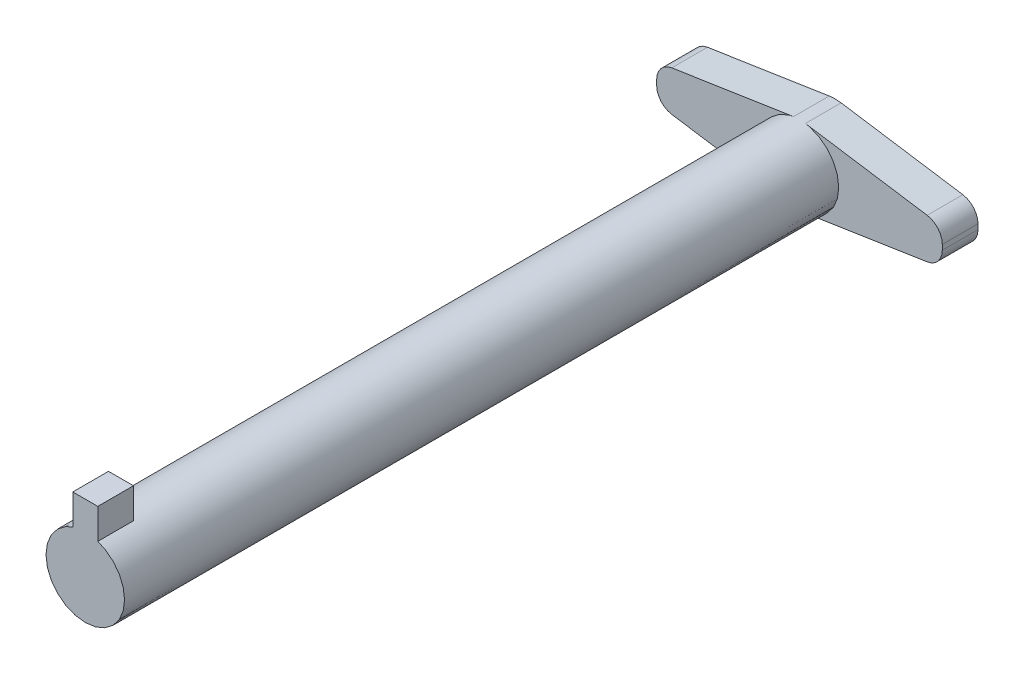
SolidWorks part; units mm, degrees
ref_plane "Front Plane" through (0, 0, 0) normal (0, 0, 1) x (1, 0, 0)
ref_plane "Top Plane" through (0, 0, 0) normal (0, 1, 0) x (1, 0, 0)
ref_plane "Right Plane" through (0, 0, 0) normal (1, 0, 0) x (0, 0, -1)
sketch "Sketch1" plane through (0, 0, 0) normal (0, 0, 1) x (1, 0, 0)
  circle A0 centre (0, 0) radius 2.413
  dimension "D1" = 4.826
extrude "Boss-Extrude1" add sketch "Sketch1" along normal blind 11.176
sketch "Sketch2" plane through (0, 0, 0) normal (0, 0, -1) x (-1, 0, 0)
  line L0 (0.2734, 2.3975) -> (10.16, 1.27)
  line L1 (10.16, 1.27) -> (10.16, -1.27)
  line L2 (10.16, -1.27) -> (0.2734, -2.3975)
  circle A0 centre (0, 0) radius 2.413 construction
  arc A1 (-0.2734, -2.3975) -> (0.2734, -2.3975) centre (0, 0) ccw
  arc A2 (0.2734, 2.3975) -> (-0.2734, 2.3975) centre (0, 0) ccw
  arc A3 (0.2734, 2.3975) -> (0.2734, -2.3975) centre (0, 0) ccw
  dimension "D2" = 2.54
  dimension "D4" = 10.16
extrude "Boss-Extrude2" add sketch "Sketch2" along normal blind 2.54 contours L2 L1 L0 M7 | M7
fillet "Fillet1" radius 1.27 2 edges at (-10.16, -1.27, -1.27) (-10.16, 1.27, -1.27)
sketch "Sketch3" plane through (0, 0, 11.176) normal (0, 0, 1) x (1, 0, 0)
  line L0 (-0.889, 2.2433) -> (-0.889, 4.4023)
  line L1 (-0.889, 4.4023) -> (0.889, 4.4023)
  line L2 (0.889, 4.4023) -> (0.889, 2.2433)
  circle A0 centre (0, 0) radius 2.413 construction
  arc A1 (0.2734, -2.3975) -> (0.2734, 2.3975) centre (0, 0) ccw construction
  arc A2 (0.889, 2.2433) -> (-0.889, 2.2433) centre (0, 0) ccw
  dimension "D1" = 1.778
  dimension "D2" = 0.889
  dimension "D3" = 2.159
extrude "Boss-Extrude3" add sketch "Sketch3" against normal blind 2.54
